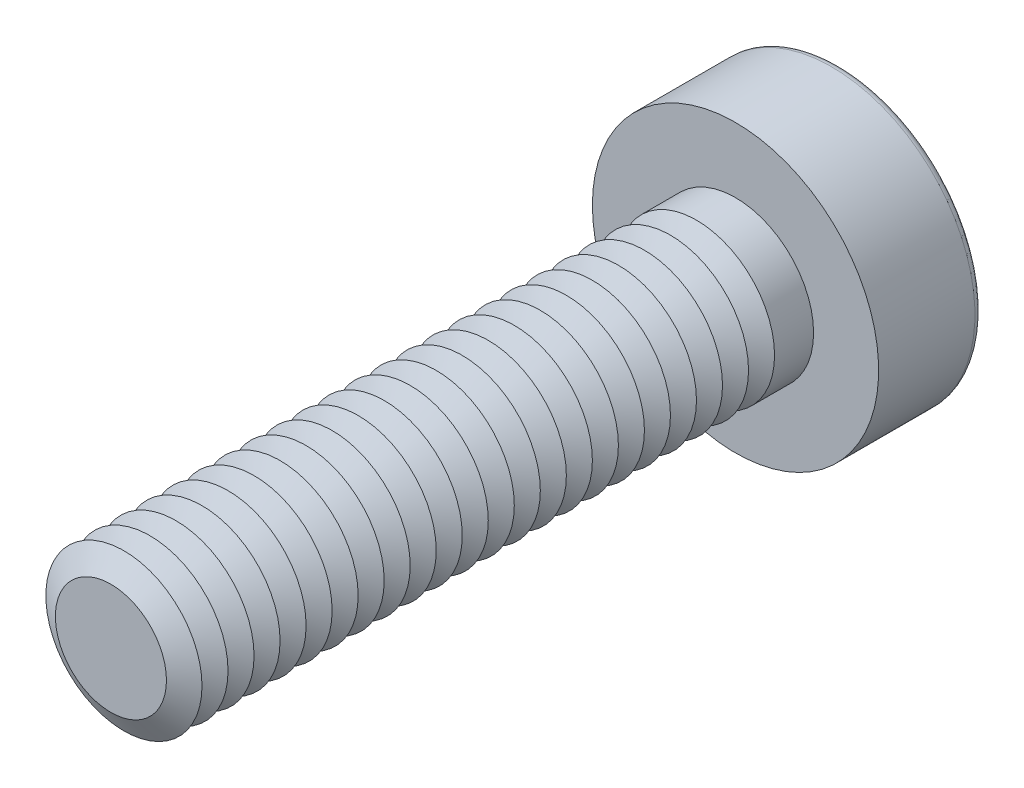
SolidWorks part; units mm, degrees
ref_plane "Front Plane" through (0, 0, 0) normal (0, 0, 1) x (1, 0, 0)
ref_plane "Top Plane" through (0, 0, 0) normal (0, 1, 0) x (1, 0, 0)
ref_plane "Right Plane" through (0, 0, 0) normal (1, 0, 0) x (0, 0, -1)
sketch "Sketch1" plane through (0, 0, 0) normal (0, 0, 1) x (1, 0, 0)
  circle A0 centre (0, 0) radius 1.5
  dimension "D1" = 3
extrude "Boss-Extrude1" add sketch "Sketch1" along normal blind 12
sketch "Sketch2" plane through (0, 0, 0) normal (0, 0, -1) x (-1, 0, 0)
  circle A0 centre (0, 0) radius 2.75
  dimension "D1" = 5.5
extrude "Boss-Extrude2" add sketch "Sketch2" along normal blind 2
sketch "Sketch3" plane through (0, 0, -2) normal (0, 0, -1) x (-1, 0, 0)
  line L1 (-0.5774, 1) -> (-1.1547, 0)
  line L2 (-1.1547, 0) -> (-0.5774, -1)
  line L3 (-0.5774, -1) -> (0.5774, -1)
  line L4 (0.5774, -1) -> (1.1547, 0)
  line L5 (1.1547, 0) -> (0.5774, 1)
  line L6 (0.5774, 1) -> (-0.5774, 1)
  circle A0 centre (0, 0) radius 1 construction
  dimension "D1" = 2
extrude "Cut-Extrude1" cut sketch "Sketch3" against normal blind 1.5
fillet "Fillet1" radius 0.15 1 edges at (-2.75, 0, -2)
sketch "Sketch4" plane through (0, 0, -0.5) normal (0, 0, -1) x (-1, 0, 0)
  line L0 (0.5774, -1) -> (1.1547, 0) construction
  circle A0 centre (0, 0) radius 1
extrude "Cut-Extrude2" cut sketch "Sketch4" against normal through all draft 60
sketch "Sketch5" plane through (0, 0, -2) normal (0, 0, -1) x (-1, 0, 0)
  circle A0 centre (0, 0) radius 1.1547
extrude "Cut-Extrude3" cut sketch "Sketch5" against normal through all draft 75
sketch "Sketch7" plane through (0, 0, 0) normal (1, 0, 0) x (0, 0, -1)
  line L25 (-12, 1.067) -> (-11.75, 1.5)
  line L26 (-12, 1.5) -> (-12, -1.5) construction
  line L27 (-11.75, 1.5) -> (-12.25, 1.5)
  line L28 (-12.25, 1.5) -> (-12, 1.067)
  line L29 (0, 1.5) -> (-12, 1.5) construction
  dimension "D1" = 0.5
revolve "Cut-Revolve1" cut sketch "Sketch7" angle 360 about axis through (0, 0, 12) along (0, 0, -1)
pattern_linear "LPattern1" count 23 spacing 0.5 along (0, 0, -1) of "Cut-Revolve1"
